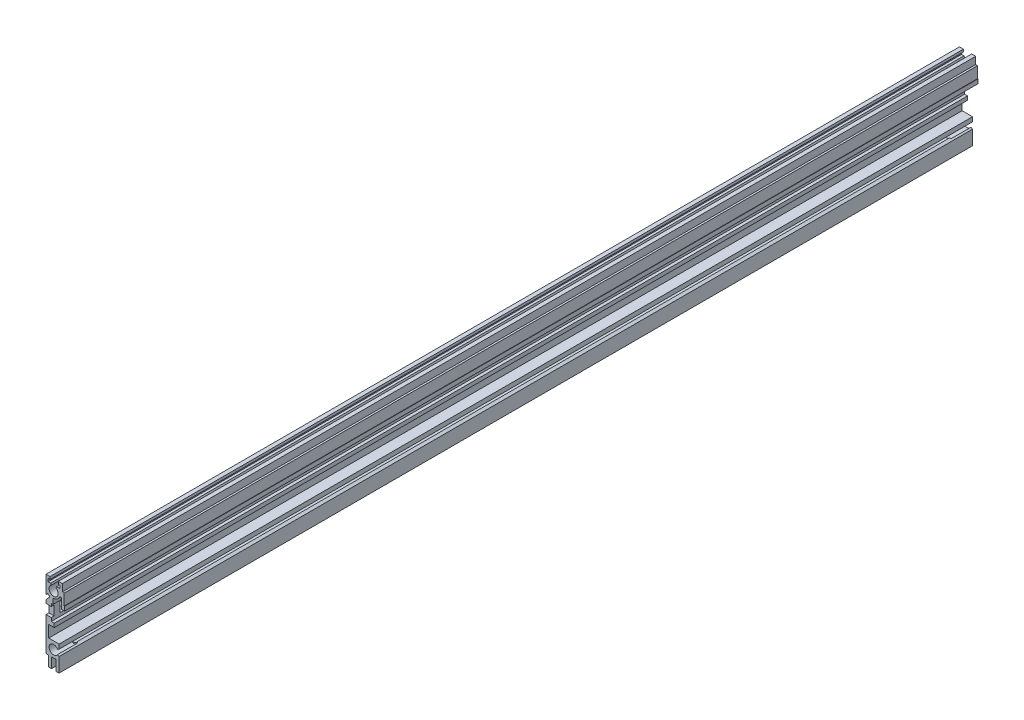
SolidWorks part; units mm, degrees
ref_plane "前视基准面" through (0, 0, 0) normal (0, 0, 1) x (1, 0, 0)
ref_plane "上视基准面" through (0, 0, 0) normal (0, 1, 0) x (1, 0, 0)
ref_plane "右视基准面" through (0, 0, 0) normal (1, 0, 0) x (0, 0, -1)
sketch "草图1" plane through (0, 0, 0) normal (0, 0, 1) x (1, 0, 0)
  line L43 (-2.5, -8.3) -> (-1, -8.3)
  line L44 (1.1, -8.3) -> (2.6, -8.3)
  line L45 (-3.6, -3.4) -> (-3.6, 18.7)
  line L46 (-3.6, 20.7928) -> (-3.6, 29.1)
  line L47 (0.3, 9.2) -> (0.3, 11)
  line L48 (-1.1, 11) -> (-1.1, 18.4)
  line L49 (-2.3, 3.6) -> (-2.3, 9.2)
  line L50 (1.1, -8.3) -> (1.1, -3.4)
  line L51 (-1, -8.3) -> (-1, -3.4)
  line L52 (-2.5, -8.3) -> (-2.5, -3.4)
  line L53 (2.2, 29.1) -> (4.1, 29.1)
  line L54 (1.4434, 26.5) -> (3.1, 26.5)
  line L55 (2.2, 27.9) -> (3.1, 27.9)
  line L56 (4.1, 25.7) -> (5, 25.7)
  line L57 (5, 20.4) -> (5.2, 20.4)
  line L58 (3.7, 18.4) -> (5.2, 18.4)
  line L59 (-1.1, 11) -> (0.3, 11)
  line L60 (-2.3, 9.2) -> (0.3, 9.2)
  line L61 (-2.3, 3.6) -> (2.6, 3.6)
  line L62 (-1, -3.4) -> (1.1, -3.4)
  line L63 (-2.5, -3.4) -> (-3.6, -3.4)
  line L64 (2.6, -8.3) -> (2.6, -1.5011)
  line L65 (5.2, 20.4) -> (5.2, 18.4)
  line L66 (5, 25.7) -> (5, 20.4)
  line L67 (-0.3, 20.5558) -> (-0.3, 18.4)
  line L68 (3.7, 22.7106) -> (3.7, 18.4)
  line L69 (1.4289, 0.825) -> (2.6, 1.5011)
  line L70 (1.4289, -0.825) -> (2.6, -1.5011)
  line L71 (2.6, 1.5011) -> (2.6, 3.6)
  line L72 (-1.1, 18.4) -> (-0.3, 18.4)
  line L73 (4.1, 25.7) -> (4.1, 29.1)
  line L74 (3.1, 26.5) -> (3.1, 27.9)
  line L75 (2.2, 27.9) -> (2.2, 29.1)
  line L76 (-0.825, 25.4289) -> (-1.4434, 26.5)
  line L77 (0.825, 25.4289) -> (1.4434, 26.5)
  line L78 (-1.4434, 26.5) -> (-2.6, 26.5)
  line L79 (-1.7, 27.9) -> (-2.6, 27.9)
  line L80 (-2.6, 26.5) -> (-2.6, 27.9)
  line L81 (-1.7, 27.9) -> (-1.7, 29.1)
  line L82 (-1.7, 29.1) -> (-3.6, 29.1)
  line L83 (-1.8, 20.7) -> (-3.6, 18.7)
  line L84 (-2.8406, 21.6366) -> (-3.6, 20.7928)
  line L85 (-1.8, 20.7) -> (-2.8406, 21.6366)
  arc A5 (-0.825, 25.4289) -> (0.825, 25.4289) centre (0, 24) ccw
  arc A6 (0.171, 21.055) -> (2.7362, 22.8975) centre (0, 24) ccw
  arc A7 (0.171, 21.055) -> (-0.3, 20.5558) centre (0.2, 20.5558) ccw
  arc A8 (3.7, 22.7106) -> (2.7362, 22.8975) centre (3.2, 22.7106) ccw
  arc A9 (1.4289, 0.825) -> (1.4289, -0.825) centre (0, 0) ccw
extrude "凸台-拉伸1" add sketch "草图1" against normal blind 431.8
sketch "草图2" plane through (-1.1, 0, 0) normal (1, 0, 0) x (0, 0, -1)
  line L0 (431.8, 29.1) -> (0, 29.1) construction
  line L1 (4.02, 17.1) -> (11.52, 17.1)
  line L2 (4.02, 17.1) -> (4.02, 12.6)
  line L3 (4.02, 12.6) -> (11.52, 12.6)
  line L4 (11.52, 17.1) -> (11.52, 12.6)
  line L5 (4.02, 17.1) -> (11.52, 12.6) construction
  line L6 (4.02, 12.6) -> (11.52, 17.1) construction
  line L7 (0, 11) -> (0, 18.4) construction
  point P0 (7.77, 14.85)
  dimension "D1" = 7.5
  dimension "D2" = 4.5
  dimension "D3" = 12
  dimension "D4" = 4.02
extrude "切除-拉伸1" cut sketch "草图2" against normal up to next
pattern_linear "阵列(线性)1" count 43 spacing 10.16 along (0, 0, -1) of "切除-拉伸1"
sketch "草图3" plane through (0, 0, 0) normal (0, 0, 1) x (1, 0, 0)
  circle A0 centre (0, 0) radius 2.15
  circle A1 centre (0, 24) radius 2.15
extrude "切除-拉伸2" cut sketch "草图3" against normal blind 9.5
sketch "草图4" plane through (0, 0, -431.8) normal (0, 0, -1) x (-1, 0, 0)
  circle A0 centre (0, 0) radius 2.15
  circle A1 centre (0, 24) radius 2.15
  dimension "D1" = 4.3
  dimension "D2" = 4.3
extrude "切除-拉伸3" cut sketch "草图4" against normal blind 9.5
sketch "草图5" plane through (-3.6, 0, 0) normal (-1, 0, 0) x (0, 0, 1)
  line L0 (0, 18.7) -> (0, -3.4) construction
  line L1 (-1.36, 17.1) -> (0, 17.1)
  line L2 (-1.36, 17.1) -> (-1.36, 12.6)
  line L3 (-1.36, 12.6) -> (0, 12.6)
  line L4 (0, 17.1) -> (0, 12.6)
  line L5 (-11.52, 17.1) -> (-4.02, 17.1) construction
  line L6 (-4.02, 12.6) -> (-11.52, 12.6) construction
  line L7 (-4.02, 17.1) -> (-4.02, 12.6) construction
  line L8 (-215.9, 29.1) -> (-215.9, -8.3) construction
  line L9 (-431.8, 29.1) -> (0, 29.1) construction
  line L10 (-431.8, -8.3) -> (0, -8.3) construction
  line L11 (-431.8, 17.1) -> (-431.8, 12.6)
  line L12 (-430.44, 12.6) -> (-431.8, 12.6)
  line L13 (-430.44, 17.1) -> (-430.44, 12.6)
  line L14 (-430.44, 17.1) -> (-431.8, 17.1)
  dimension "D1" = 2.66
extrude "切除-拉伸4" cut sketch "草图5" against normal blind 10
